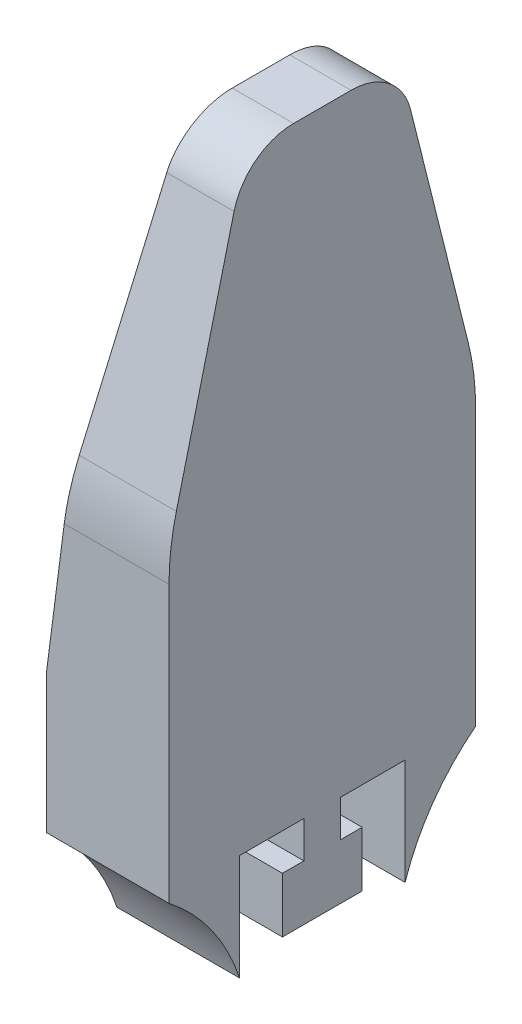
SolidWorks part; units mm, degrees
ref_plane "Front Plane" through (0, 0, 0) normal (0, 0, 1) x (1, 0, 0)
ref_plane "Top Plane" through (0, 0, 0) normal (0, 1, 0) x (1, 0, 0)
ref_plane "Right Plane" through (0, 0, 0) normal (1, 0, 0) x (0, 0, -1)
sketch "Sketch1" plane through (0, 0, 0) normal (1, 0, 0) x (0, 0, -1)
  line L0 (4, 10) -> (12.5, 10)
  line L1 (-12.5, -10) -> (12.5, -10)
  line L2 (-12.5, -10) -> (-12.5, 10)
  line L3 (-12.5, 10) -> (-4, 10)
  line L4 (12.5, -10) -> (12.5, 10)
  line L5 (-12.5, -10) -> (12.5, 10) construction
  line L6 (-12.5, 10) -> (12.5, -10) construction
  line L7 (-7.5, 6) -> (-4, 6)
  line L8 (-7.5, 6) -> (-7.5, -5)
  line L9 (-7.5, -5) -> (7.5, -5)
  line L10 (7.5, 6) -> (7.5, -5)
  line L12 (-4, 10) -> (-4, 6)
  line L14 (4, 10) -> (4, 6)
  line L15 (4, 6) -> (7.5, 6)
  point P0 (0, 0)
  dimension "D1" = 25
  dimension "D2" = 20
  dimension "D3" = 5
  dimension "D4" = 5
  dimension "D5" = 8.5
  dimension "D6" = 8.5
  dimension "D7" = 5
sketch "Sketch2" plane through (0, 0, 0) normal (1, 0, 0) x (0, 0, -1)
  line L6 (-25, 10) -> (-25, 55.0758)
  line L7 (-4.6922, 110) -> (4.6922, 110)
  line L8 (25, 10) -> (25, 55.0758)
  line L9 (0, 0) -> (0, 6.5229)
  line L10 (23.8057, 64.7772) -> (14.3937, 102.4254)
  line L11 (-23.8057, 64.7772) -> (-14.3937, 102.4254)
  line L12 (-7.5, -5) -> (7.5, -5) construction
  line L13 (-6.5, -4) -> (6.5, -4)
  line L14 (-6.5, -4) -> (-6.5, 5)
  line L15 (-6.5, 5) -> (-3, 5)
  line L16 (6.5, -4) -> (6.5, 5)
  line L17 (7.5, 6) -> (7.5, -5) construction
  line L18 (-7.5, 6) -> (-7.5, -5) construction
  line L19 (-7.5, 6) -> (-4, 6) construction
  line L20 (-4, 10) -> (-4, 6) construction
  line L22 (-3, 5) -> (-3, 11)
  line L24 (3, 5) -> (3, 11)
  line L25 (4, 10) -> (4, 6) construction
  line L26 (-12.5, -10) -> (-12.5, 10) construction
  line L28 (-13.5, -6.2904) -> (-13.5, 11)
  line L29 (-13.5, 11) -> (-3, 11)
  line L30 (13.5, -6.2904) -> (13.5, 11)
  line L31 (12.5, -10) -> (12.5, 10) construction
  line L32 (3, 11) -> (13.5, 11)
  line L33 (3, 5) -> (6.5, 5)
  arc A0 (25, 10) -> (13.5, -6.2904) centre (46.0273, -17.0483) ccw
  arc A1 (-25, 10) -> (-13.5, -6.2904) centre (-46.0273, -17.0483) cw
  arc A2 (-23.8057, 64.7772) -> (-25, 55.0758) centre (15, 55.0758) ccw
  arc A3 (23.8057, 64.7772) -> (25, 55.0758) centre (-15, 55.0758) cw
  arc A4 (-14.3937, 102.4254) -> (-4.6922, 110) centre (-4.6922, 100) cw
  arc A5 (14.3937, 102.4254) -> (4.6922, 110) centre (4.6922, 100) ccw
  dimension "D1" = 40
  dimension "D2" = 10
  dimension "D3" = 1
  dimension "D4" = 1
  dimension "D5" = 1
  dimension "D6" = 1
  dimension "D7" = 1
  dimension "D8" = 1
  dimension "D9" = 1
  dimension "D10" = 1
  dimension "D11" = 1
extrude "Boss-Extrude2" add sketch "Sketch2" against normal blind 20 contours L8 A3 L10 A5 L7 A4 L11 A2 L6 A1 L28 L29 L22 L15 L14 L13 L16 L33 L24 L32 L30 A0
sketch "Sketch3" plane through (0, 0, 0) normal (0, 0, 1) x (1, 0, 0)
  line L0 (-10, 110) -> (-20, 32.5379)
  line L1 (-20, 110) -> (0, 110) construction
  line L2 (-20, 10) -> (-20, 55.0758) construction
  line L3 (-20, 32.5379) -> (-20, 110)
  line L4 (-20, 110) -> (-10, 110)
extrude "Cut-Extrude1" cut sketch "Sketch3" against normal through all both and the other way through all
